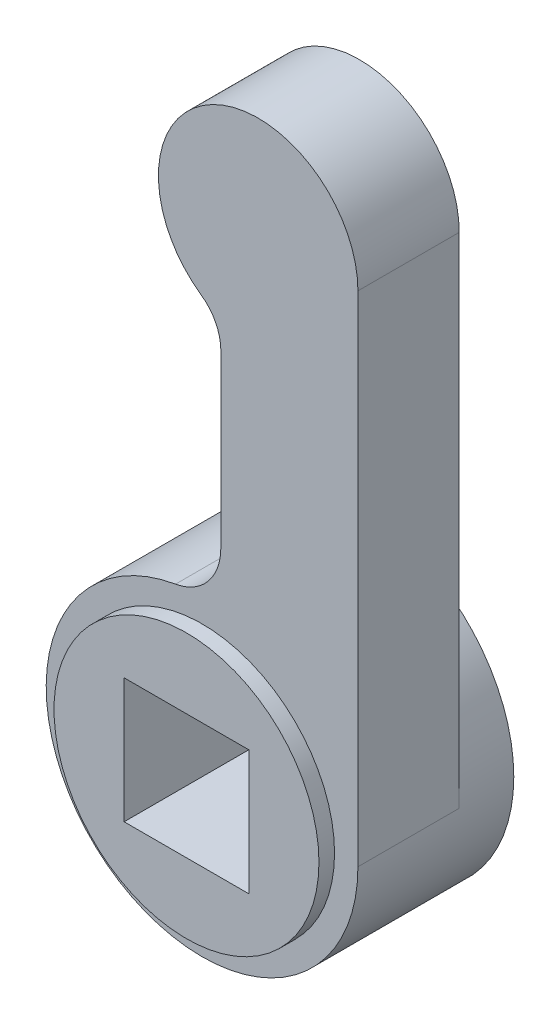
SolidWorks part; units mm, degrees
ref_plane "Ebene vorne" through (0, 0, 0) normal (0, 0, 1) x (1, 0, 0)
ref_plane "Ebene oben" through (0, 0, 0) normal (0, 1, 0) x (1, 0, 0)
ref_plane "Ebene rechts" through (0, 0, 0) normal (1, 0, 0) x (0, 0, -1)
sketch "Skizze1" plane through (0, 0, 0) normal (0, 0, 1) x (1, 0, 0)
  line L1 (-4, 4) -> (4, 4)
  line L2 (-4, 4) -> (-4, -4)
  line L3 (-4, -4) -> (4, -4)
  line L4 (4, 4) -> (4, -4)
  line L5 (-4, 4) -> (4, -4) construction
  line L6 (-4, -4) -> (4, 4) construction
  circle A0 centre (0, 0) radius 10
  point P0 (0, 0)
  dimension "D3" = 20
  dimension "D1" = 8
  dimension "D2" = 8
extrude "Linear austragen1" add sketch "Skizze1" along normal mid plane 10
sketch "Skizze2" plane through (0, 0, 0) normal (0, 0, 1) x (1, 0, 0)
  line L0 (10, 0) -> (10, 32)
  line L1 (1.2037, 13.3033) -> (1.2037, 24.3033)
  line L4 (4, -4) -> (4, 4) construction
  line L5 (-12.4985, 0) -> (15.4455, 0) construction
  circle A0 centre (0, 0) radius 10 construction
  arc A1 (-1.701, 9.8543) -> (1.2037, 13.3033) centre (-2.2963, 13.3033) ccw
  arc A2 (1.2037, 24.3033) -> (-0.0741, 26.7597) centre (-1.7963, 24.3033) ccw
  arc A3 (-0.0741, 26.7597) -> (10, 32) centre (3.6, 32) cw
  arc A4 (-1.701, 9.8543) -> (10, 0) centre (0, 0) cw
  dimension "D2" = 6.4
  dimension "D1" = 3
  dimension "D4" = 3.5
  dimension "D3" = 32
  dimension "D5" = 11
extrude "Linear austragen4" add sketch "Skizze2" along normal blind 5 and the other way blind 1.5
sketch "Skizze3" plane through (0, 0, 0) normal (0, 0, 1) x (1, 0, 0)
  line L1 (-4, 4) -> (4, 4)
  line L2 (-4, 4) -> (-4, -4)
  line L3 (-4, -4) -> (4, -4)
  line L4 (4, 4) -> (4, -4)
  line L5 (-4, 4) -> (4, -4) construction
  line L6 (-4, -4) -> (4, 4) construction
  circle A0 centre (0, 0) radius 8.5
  dimension "D1" = 17
extrude "Linear austragen5" add sketch "Skizze3" along normal mid plane 12
